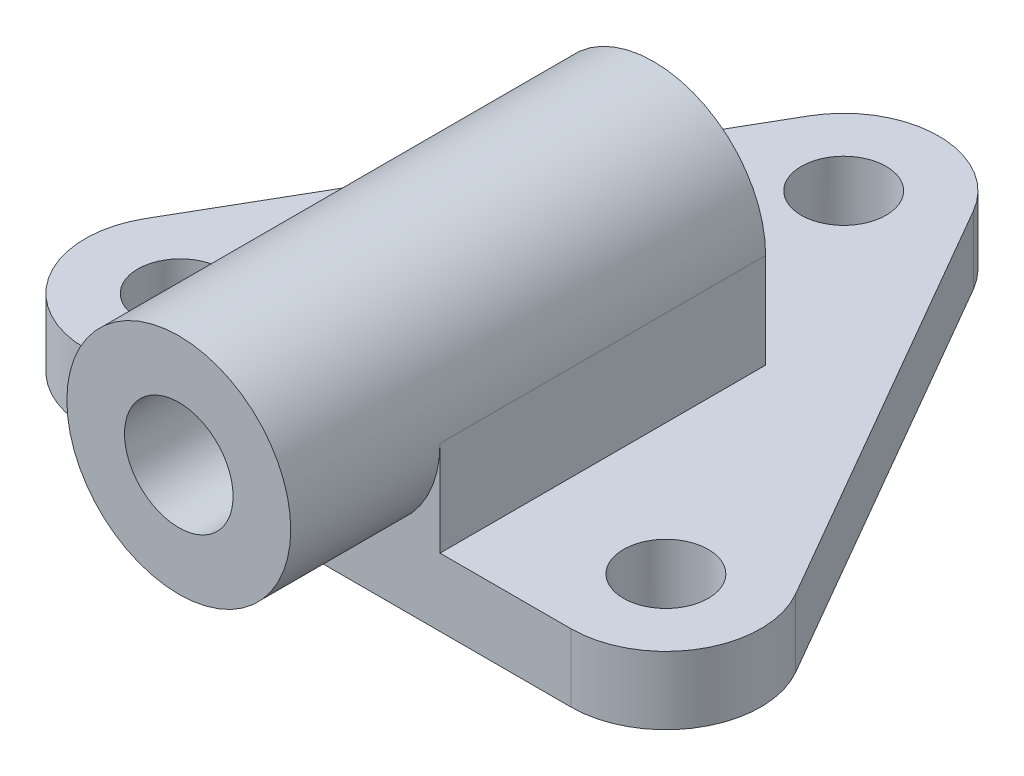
SolidWorks part; units mm, degrees
ref_plane "Front Plane" through (0, 0, 0) normal (0, 0, 1) x (1, 0, 0)
ref_plane "Top Plane" through (0, 0, 0) normal (0, 1, 0) x (1, 0, 0)
ref_plane "Right Plane" through (0, 0, 0) normal (1, 0, 0) x (0, 0, -1)
sketch "Sketch1" plane through (0, 0, 0) normal (0, 1, 0) x (1, 0, 0)
  line L1 (-12.1244, 48.3333) -> (-47.9201, -13.6667)
  line L2 (-35.7957, -34.6667) -> (35.7957, -34.6667)
  line L3 (47.9201, -13.6667) -> (12.1244, 48.3333)
  circle A0 centre (0, 0) radius 34.6667 construction
  arc A1 (-12.1244, 48.3333) -> (12.1244, 48.3333) centre (0, 41.3333) cw
  arc A2 (-47.9201, -13.6667) -> (-35.7957, -34.6667) centre (-35.7957, -20.6667) ccw
  arc A3 (35.7957, -34.6667) -> (47.9201, -13.6667) centre (35.7957, -20.6667) ccw
  point P8 (0, 69.3333)
  point P11 (-60.0444, -34.6667)
  point P14 (60.0444, -34.6667)
  dimension "D2" = 14
  dimension "D1" = 62
extrude "Extrude1" add sketch "Sketch1" along normal blind 10
sketch "Sketch3" plane through (0, 0, 34.6667) normal (0, 0, 1) x (1, 0, 0)
  line L0 (16.5, 24) -> (16.5, 10)
  line L2 (-35.7957, 10) -> (35.7957, 10) construction
  line L3 (-16.5, 24) -> (-16.5, 10)
  line L4 (-16.5, 10) -> (16.5, 10)
  circle A0 centre (0, 24) radius 8
  arc A1 (16.5, 24) -> (-16.5, 24) centre (0, 24) ccw
  dimension "D3" = 33
  dimension "D2" = 16
  dimension "D1" = 24
extrude "Extrude3" add sketch "Sketch3" against normal blind 48
sketch "Sketch4" plane through (0, 0, 34.6667) normal (0, 0, 1) x (1, 0, 0)
  circle A0 centre (0, 24) radius 16.5
  circle A1 centre (0, 24) radius 8 construction
  circle A2 centre (0, 24) radius 8
extrude "Extrude4" add sketch "Sketch4" along normal blind 22
hole_wizard "M14x1.5 Tapped Hole1" positions "Sketch6" profile "Sketch5" tap size "M14x1.5" standard "Ansi Metric"
sketch "Sketch6" plane through (0, 10, 0) normal (0, 1, 0) x (-1, 0, 0)
  point P0 (0, -41.3333)
  point P1 (-35.7957, 20.6667)
  point P4 (35.7957, 20.6667)
sketch "Sketch5" plane through (0, 10, -41.3333) normal (1, 0, 0) x (0, 0, 1)
  line L0 (0, 0) -> (0, 36.2554)
  line L1 (0, 36.2554) -> (6.25, 32.5)
  line L2 (6.25, 32.5) -> (6.25, 0)
  line L5 (6.25, 0) -> (0, 0)
  line L10 (0, 36.2554) -> (-6.25, 32.5) construction
  line L11 (0, -6.35) -> (0, 107.95) construction
  dimension "Tap Drill Dia." = 12.5
  dimension "Tap Drill Depth" = 32.5
  dimension "Drill Angle" = 118
